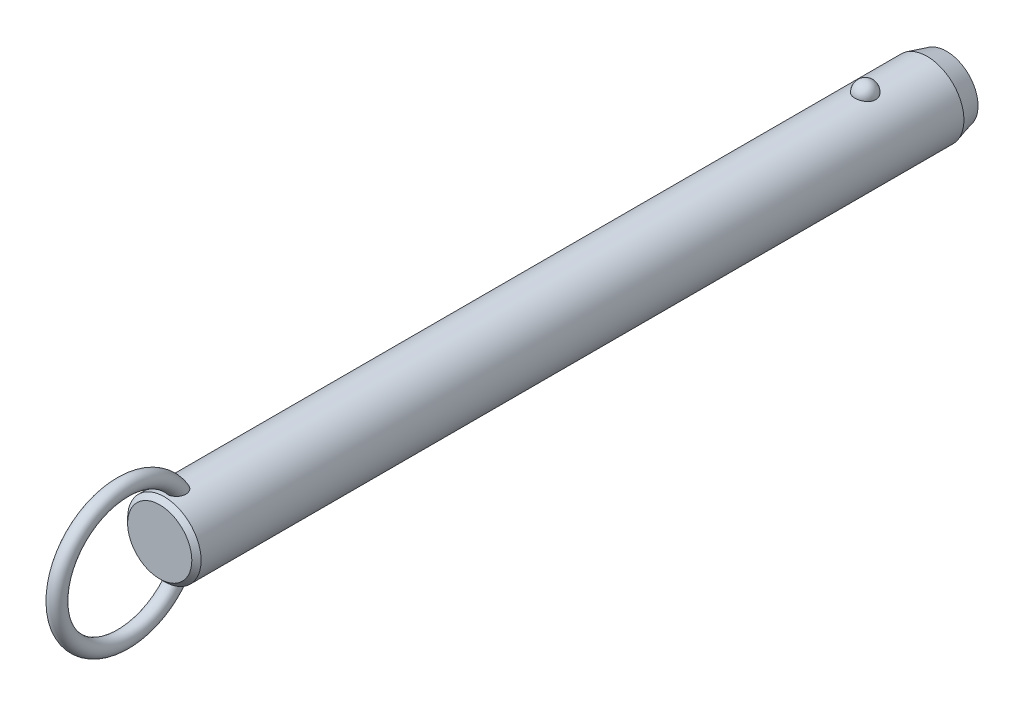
SolidWorks part; units mm, degrees
ref_plane "Front Plane" through (0, 0, 0) normal (0, 0, 1) x (1, 0, 0)
ref_plane "Top Plane" through (0, 0, 0) normal (0, 1, 0) x (1, 0, 0)
ref_plane "Right Plane" through (0, 0, 0) normal (1, 0, 0) x (0, 0, -1)
sketch "Sketch2" plane through (0, 0, 0) normal (0, 0, 1) x (1, 0, 0)
  circle A0 centre (0, 0) radius 9.5
  point P3 (0, 9.5)
  dimension "D1" = 19
extrude "Boss-Extrude1" add sketch "Sketch2" along normal blind 170.2
sketch "Sketch3" plane through (0, 0, 0) normal (0, 0, -1) x (-1, 0, 0)
  circle A0 centre (0, 0) radius 9.5
  dimension "D1" = 19
extrude "Boss-Extrude2" add sketch "Sketch3" along normal blind 23.7
chamfer "Chamfer1" distance 5 angle 15 1 edges at (-9.5, 0, -23.7)
sketch "Sketch12" plane through (0, 0, 0) normal (1, 0, 0) x (0, 0, -1)
  line L0 (-170.2, 9.5) -> (-170.2, -9.5) construction
  point P0 (-170.2, 0)
sketch "Sketch13" plane through (0, 0, 0) normal (1, 0, 0) x (0, 0, -1)
  circle A0 centre (-189.25, 0) radius 19.05
  point P2 (-170.2, 0)
  dimension "D1" = 38.1
sketch "Sketch14" plane through (0, 0, 0) normal (0, 1, 0) x (1, 0, 0)
  circle A0 centre (0, -172.2) radius 2
  point P2 (0, -170.2)
  dimension "D1" = 4
sweep "Sweep1" add profiles "Sketch14" path "Sketch13"
sketch "Sketch15" plane through (0, 0, 170.2) normal (0, 0, 1) x (1, 0, 0)
  circle A0 centre (0, 0) radius 9.5
  dimension "D1" = 19
extrude "Boss-Extrude3" add sketch "Sketch15" along normal blind 9.52
chamfer "Chamfer2" distance 1.2 angle 45 1 edges at (9.5, 0, 179.72)
sketch "Sketch18" plane through (0, 0, 0) normal (1, 0, 0) x (0, 0, -1)
  line L0 (18.7, 9.5) -> (-172.7378, 9.5) construction
  line L1 (2.7, 12.2) -> (2.7, 6.8)
  line L2 (-172.7378, -9.5) -> (18.7, -9.5) construction
  arc A0 (2.7, 12.2) -> (2.7, 6.8) centre (2.7, 9.5) ccw
  point P4 (0, 9.5)
  dimension "D1" = 21.7
revolve "Revolve1" add sketch "Sketch18" angle 360 about L1
